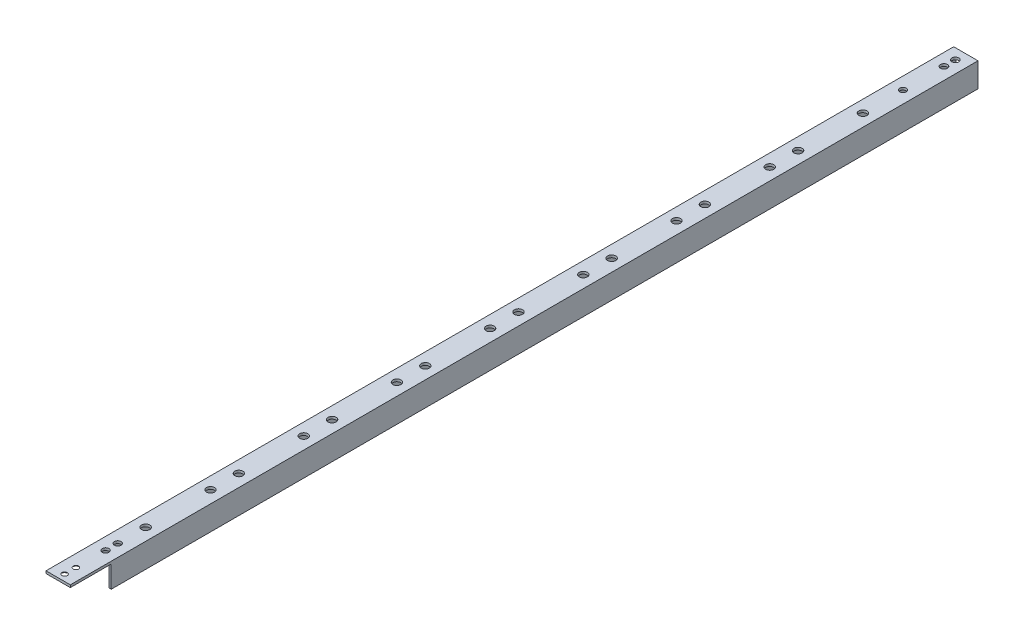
SolidWorks part; units mm, degrees
ref_plane "Front Plane" through (0, 0, 0) normal (0, 0, 1) x (1, 0, 0)
ref_plane "Top Plane" through (0, 0, 0) normal (0, 1, 0) x (1, 0, 0)
ref_plane "Right Plane" through (0, 0, 0) normal (1, 0, 0) x (0, 0, -1)
sketch "Sketch2" plane through (0, 0, 0) normal (0, 0, 1) x (1, 0, 0)
  line L1 (-15, -15) -> (15, -15)
  line L2 (-15, -15) -> (-15, 15)
  line L3 (-15, 15) -> (15, 15)
  line L4 (15, -15) -> (15, 15)
  line L5 (-15, -15) -> (15, 15) construction
  line L6 (-15, 15) -> (15, -15) construction
  point P0 (0, 0)
  dimension "D1" = 30
  dimension "D2" = 30
extrude "Boss-Extrude1" add sketch "Sketch2" along normal mid plane 1120
sketch "Sketch3" plane through (0, 0, 560) normal (0, 0, 1) x (1, 0, 0)
  line L0 (-15, -15) -> (15, -15) construction
  line L1 (12, -15) -> (-12, -15)
  line L2 (12, -15) -> (12, 12)
  line L3 (12, 12) -> (-12, 12)
  line L4 (-12, -15) -> (-12, 12)
  line L5 (-15, 15) -> (-15, -15) construction
  line L6 (15, 15) -> (-15, 15) construction
  line L7 (15, -15) -> (15, 15) construction
  dimension "D1" = 3
  dimension "D2" = 3
  dimension "D3" = 3
extrude "Cut-Extrude1" cut sketch "Sketch3" against normal through all
sketch "Sketch4" plane through (0, 15, 0) normal (0, 1, 0) x (1, 0, 0)
  line L0 (0, -560) -> (0, 560) construction
  line L1 (15, -560) -> (-15, -560) construction
  line L2 (15, 560) -> (-15, 560) construction
  line L3 (-15, 0) -> (15, 0) construction
  line L4 (-15, -560) -> (-15, 560) construction
  line L5 (15, -560) -> (15, 560) construction
  point P12 (0, 0)
  point P13 (0, -67)
  point P14 (0, 48)
  point P15 (0, -182)
  point P16 (0, -297)
  point P17 (0, -412)
  point P18 (0, 163)
  point P19 (0, 278)
  point P20 (0, 393)
  point P21 (0, -452)
  point P22 (0, -372)
  point P23 (0, -337)
  point P24 (0, -257)
  point P25 (0, -222)
  point P26 (0, -142)
  point P27 (0, -107)
  point P28 (0, -27)
  point P29 (0, 8)
  point P30 (0, 88)
  point P31 (0, 123)
  point P32 (0, 203)
  point P33 (0, 238)
  point P34 (0, 318)
  point P35 (0, 353)
  point P36 (0, 433)
  dimension "D1" = 67
  dimension "D2" = 48
  dimension "D3" = 115
  dimension "D4" = 115
  dimension "D5" = 115
  dimension "D6" = 115
  dimension "D7" = 115
  dimension "D8" = 115
  dimension "D9" = 40
  dimension "D10" = 40
  dimension "D11" = 40
  dimension "D12" = 40
  dimension "D13" = 40
  dimension "D14" = 40
  dimension "D15" = 40
  dimension "D16" = 40
  dimension "D17" = 40
  dimension "D18" = 40
  dimension "D19" = 40
  dimension "D20" = 40
  dimension "D21" = 40
  dimension "D22" = 40
  dimension "D23" = 40
  dimension "D24" = 40
hole_wizard "Ø10.0mm Dowel Hole1" positions "Sketch7" profile "Sketch8" hole size "Ø10.0" standard "ISO"
sketch "Sketch7" plane through (0, 15, 0) normal (0, 1, 0) x (1, 0, 0)
  point P24 (0, -452)
  point P27 (0, -372)
  point P30 (0, -337)
  point P33 (0, -257)
  point P36 (0, -222)
  point P39 (0, -142)
  point P42 (0, -107)
  point P45 (0, -27)
  point P49 (0, 8)
  point P52 (0, 88)
  point P55 (0, 123)
  point P58 (0, 203)
  point P61 (0, 238)
  point P64 (0, 318)
  point P67 (0, 353)
  point P70 (0, 433)
sketch "Sketch8" plane through (0, 15, 452) normal (1, 0, 0) x (0, 0, 1)
  line L0 (0, 0) -> (0, 3)
  line L1 (0, 3) -> (5, 3)
  line L2 (5, 3) -> (5, 0)
  line L5 (5, 0) -> (0, 0)
  line L11 (0, -6.35) -> (0, 107.95) construction
  dimension "Thru Hole Dia." = 10
  dimension "Thru Hole Depth" = 3
sketch "Sketch9" plane through (0, 12, 0) normal (0, -1, 0) x (-1, 0, 0)
  line L0 (-12, -560) -> (12, -560) construction
  line L1 (-12, 560) -> (12, 560) construction
  line L2 (12, 560) -> (12, -560) construction
  circle A0 centre (0, 547) radius 4.25
  circle A1 centre (0, 533) radius 4.25
  circle A2 centre (0, -538) radius 3.1
  circle A3 centre (0, -552) radius 3.1
  point P7 (0, 560)
  point P13 (0, -560)
  dimension "D1" = 8.5
  dimension "D4" = 6.2
  dimension "D5" = 6.2
  dimension "D6" = 8
  dimension "D7" = 14
  dimension "D8" = 12
  dimension "D2" = 14
  dimension "D3" = 13
extrude "Cut-Extrude2" cut sketch "Sketch9" against normal through all
sketch "Sketch10" plane through (0, 0, 560) normal (0, 0, 1) x (1, 0, 0)
  line L0 (15, 12) -> (12, 12)
  line L1 (-12, 12) -> (-15, 12)
  line L8 (-12, 12) -> (12, 12)
  line L9 (12, 12) -> (12, -15)
  line L10 (12, -15) -> (15, -15)
  line L11 (15, -15) -> (15, 15)
  line L12 (15, 15) -> (-15, 15)
  line L13 (-15, 15) -> (-15, -15)
  line L14 (-15, -15) -> (-12, -15)
  line L15 (-12, -15) -> (-12, 12)
  line L16 (-12, 12) -> (12, 12)
  line L17 (12, 12) -> (12, -15)
  line L18 (12, -15) -> (15, -15)
  line L19 (15, -15) -> (15, 15)
  line L20 (15, 15) -> (-15, 15)
  line L21 (-15, 15) -> (-15, -15)
  line L22 (-15, -15) -> (-12, -15)
  line L23 (-12, -15) -> (-12, 12)
  dimension "D1" = 0
extrude "Cut-Extrude3" cut sketch "Sketch10" against normal blind 50.5 contours L1 M17 M15 M16 | L0 M13 M11 M12
sketch "Sketch12" plane through (0, 12, 0) normal (0, -1, 0) x (-1, 0, 0)
  line L0 (12, -509.5) -> (15, -509.5) construction
  line L1 (12, 560) -> (12, -509.5) construction
  circle A0 centre (0, -501.5) radius 4.1
  circle A1 centre (0, -486.5) radius 4.1
  dimension "D1" = 8.2
  dimension "D2" = 8.2
  dimension "D5" = 12
  dimension "D3" = 15
  dimension "D4" = 8
  dimension "D6" = 12
extrude "Cut-Extrude4" cut sketch "Sketch12" against normal blind 10
sketch "Sketch13" plane through (0, 12, 0) normal (0, -1, 0) x (-1, 0, 0)
  line L0 (-12, 560) -> (12, 560) construction
  line L1 (-12, 560) -> (-12, -509.5) construction
  circle A0 centre (0, 482.5) radius 4.1
  dimension "D1" = 8.2
  dimension "D2" = 77.5
  dimension "D3" = 12
extrude "Cut-Extrude5" cut sketch "Sketch13" against normal blind 10
hole_wizard "CSK for M6 Countersunk Flat Head Screw1" positions "3DSketch1" profile "Sketch14" countersink size "M6" standard "ISO"
sketch3d "3DSketch1"
  line L0 (0, 15, 538) -> (0, 12, 538) construction
  line L1 (0, 15, 552) -> (0, 12, 552) construction
  point P0 (0, 12, 538)
  point P4 (0, 12, 552)
sketch "Sketch14" plane through (0, 12, 538) normal (1, 0, 0) x (0, 0, -1)
  line L0 (0, 0) -> (0, 14.3828)
  line L1 (0, 14.3828) -> (3.3, 12.4)
  line L2 (3.3, 12.4) -> (3.3, 3)
  line L3 (3.3, 3) -> (6.3, 0)
  line L5 (6.3, 0) -> (0, 0)
  line L6 (-3.3, 3) -> (-6.3, 0) construction
  line L10 (0, 14.3828) -> (-3.3, 12.4) construction
  line L11 (0, -6.35) -> (0, 107.95) construction
  dimension "Hole Dia." = 6.6
  dimension "Hole Depth" = 12.4
  dimension "Near C'Sink Dia." = 12.6
  dimension "Near C'Sink Angle" = 90
  dimension "Drill Angle" = 118
